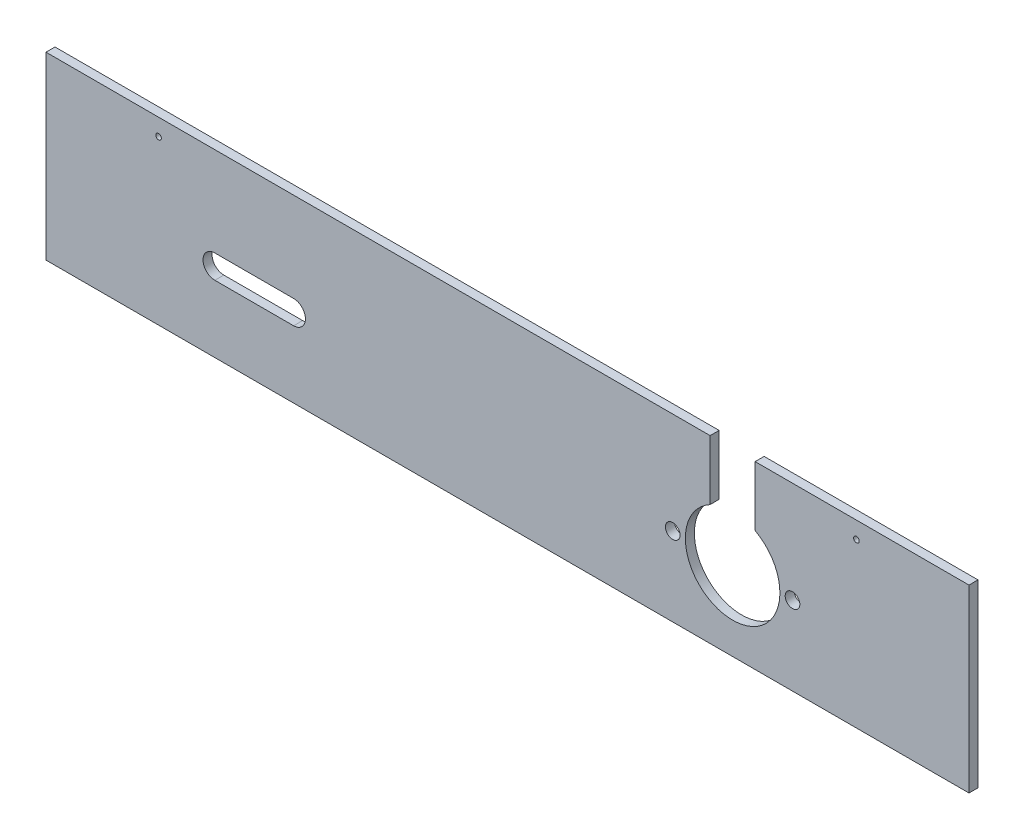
SolidWorks part; units mm, degrees
ref_plane "Face" through (0, 0, 0) normal (0, 0, 1) x (1, 0, 0)
ref_plane "Dessus" through (0, 0, 0) normal (0, 1, 0) x (1, 0, 0)
ref_plane "Droite" through (0, 0, 0) normal (1, 0, 0) x (0, 0, -1)
sketch "Esquisse1" plane through (0, 0, 0) normal (0, 0, 1) x (1, 0, 0)
  line L0 (150, -79.5) -> (220, -79.5)
  line L1 (0, 0) -> (820, 0)
  line L2 (0, 0) -> (0, -160)
  line L3 (0, -160) -> (820, -160)
  line L4 (820, 0) -> (820, -160)
  line L5 (150, -100.5) -> (220, -100.5)
  arc A0 (150, -79.5) -> (150, -100.5) centre (150, -90) ccw
  arc A1 (220, -100.5) -> (220, -79.5) centre (220, -90) ccw
  circle A5 centre (720, -15) radius 2.5
  circle A6 centre (100, -15) radius 2.5
  dimension "D3" = 21
  dimension "D11" = 5
  dimension "D1" = 820
  dimension "D2" = 160
  dimension "D4" = 70
  dimension "D5" = 70
  dimension "D6" = 100
  dimension "D13" = 720
  dimension "D14" = 15
  dimension "D15" = 150
extrude "Base-Extrusion" add sketch "Esquisse1" along normal blind 8
sketch "Esquisse2" plane through (0, 0, 8) normal (0, 0, 1) x (1, 0, 0)
  line L0 (0, -160) -> (820, -160) construction
  line L1 (0, 0) -> (0, -160) construction
  line L2 (630, -53.0676) -> (630, 0)
  line L3 (820, 0) -> (0, 0) construction
  line L4 (590, -53.0676) -> (590, 0)
  line L5 (630, 0) -> (590, 0)
  arc A0 (590, -53.0676) -> (630, -53.0676) centre (610, -90) ccw
  circle A1 centre (663.2, -90) radius 6.5
  circle A2 centre (556.8, -90) radius 6.5
  dimension "D3" = 13
  dimension "D6" = 84
  dimension "D1" = 53.2
  dimension "D2" = 53.2
  dimension "D4" = 70
  dimension "D5" = 610
  dimension "D7" = 20
  dimension "D8" = 40
extrude "Enlèv. mat.-Extru.1" cut sketch "Esquisse2" against normal through all
sketch "Esquisse3" plane through (0, 0, 8) normal (0, 0, 1) x (1, 0, 0)
  line L0 (630, -90) -> (630, 0)
  line L1 (590, -90) -> (590, 0)
  line L2 (590, 0) -> (630, 0)
  line L3 (0, -160) -> (820, -160) construction
  line L4 (0, 0) -> (0, -160) construction
  line L5 (820, 0) -> (0, 0) construction
  circle A0 centre (668.5, -90) radius 6.5
  arc A1 (590, -90) -> (630, -90) centre (610, -90) ccw
  circle A2 centre (551.5, -90) radius 6.5
  dimension "D1" = 13
  dimension "D2" = 55.2999
  dimension "D3" = 68.679
  dimension "D4" = 58.5
  dimension "D5" = 70
  dimension "D6" = 610
extrude "Enlèv. mat.-Extru.2" cut sketch "Esquisse3" against normal through all
